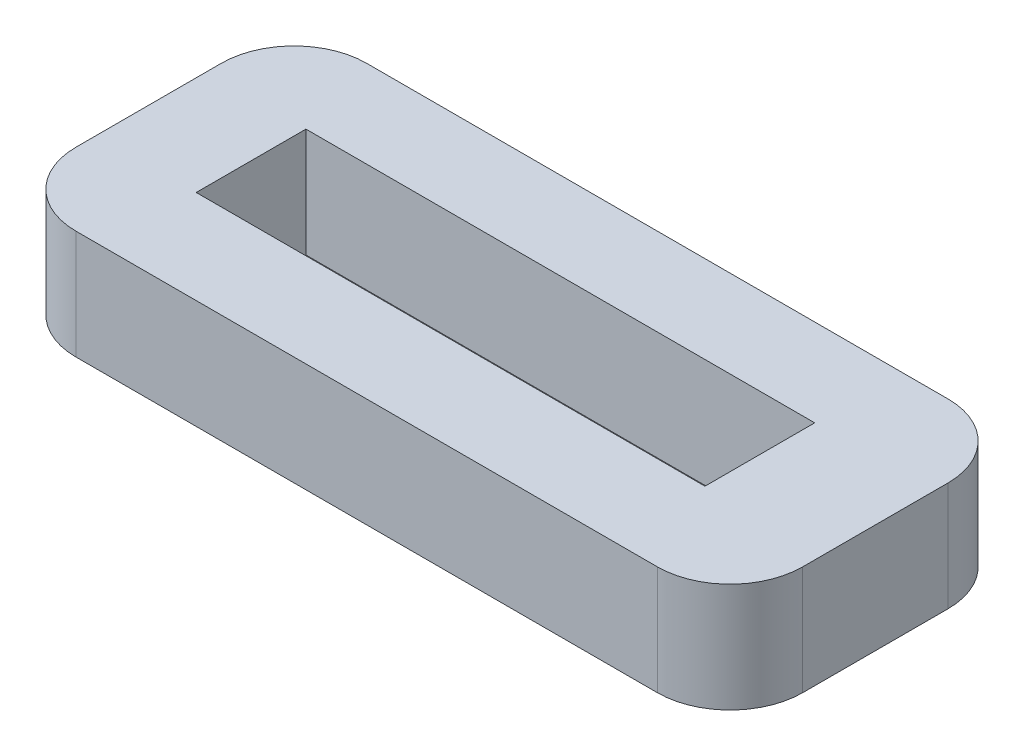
SolidWorks part; units mm, degrees
ref_plane "Front Plane" through (0, 0, 0) normal (0, 0, 1) x (1, 0, 0)
ref_plane "Top Plane" through (0, 0, 0) normal (0, 1, 0) x (1, 0, 0)
ref_plane "Right Plane" through (0, 0, 0) normal (1, 0, 0) x (0, 0, -1)
sketch "Sketch1" plane through (0, 0, 0) normal (0, 1, 0) x (1, 0, 0)
  line L1 (-85.3776, 21.2633) -> (-5.3776, 21.2633)
  line L2 (-95.3776, 11.2633) -> (-95.3776, -8.7367)
  line L3 (-85.3776, -18.7367) -> (-5.3776, -18.7367)
  line L4 (4.6224, 11.2633) -> (4.6224, -8.7367)
  line L5 (-81.7102, 9.2449) -> (-11.7102, 9.2449)
  line L6 (-81.7102, 9.2449) -> (-81.7102, -5.8551)
  line L7 (-81.7102, -5.8551) -> (-11.7102, -5.8551)
  line L8 (-11.7102, 9.2449) -> (-11.7102, -5.8551)
  arc A0 (-85.3776, 21.2633) -> (-95.3776, 11.2633) centre (-85.3776, 11.2633) ccw
  arc A1 (-95.3776, -8.7367) -> (-85.3776, -18.7367) centre (-85.3776, -8.7367) ccw
  arc A2 (-5.3776, -18.7367) -> (4.6224, -8.7367) centre (-5.3776, -8.7367) ccw
  arc A3 (-5.3776, 21.2633) -> (4.6224, 11.2633) centre (-5.3776, 11.2633) cw
  point P6 (-95.3776, 21.2633)
  point P11 (4.6224, -18.7367)
  point P14 (4.6224, 21.2633)
  dimension "D3" = 10
  dimension "D4" = 10
  dimension "D5" = 10
  dimension "D6" = 10
  dimension "D1" = 40
  dimension "D2" = 100
  dimension "D7" = 15.1
  dimension "D8" = 70
extrude "Boss-Extrude1" add sketch "Sketch1" along normal mid plane 15
